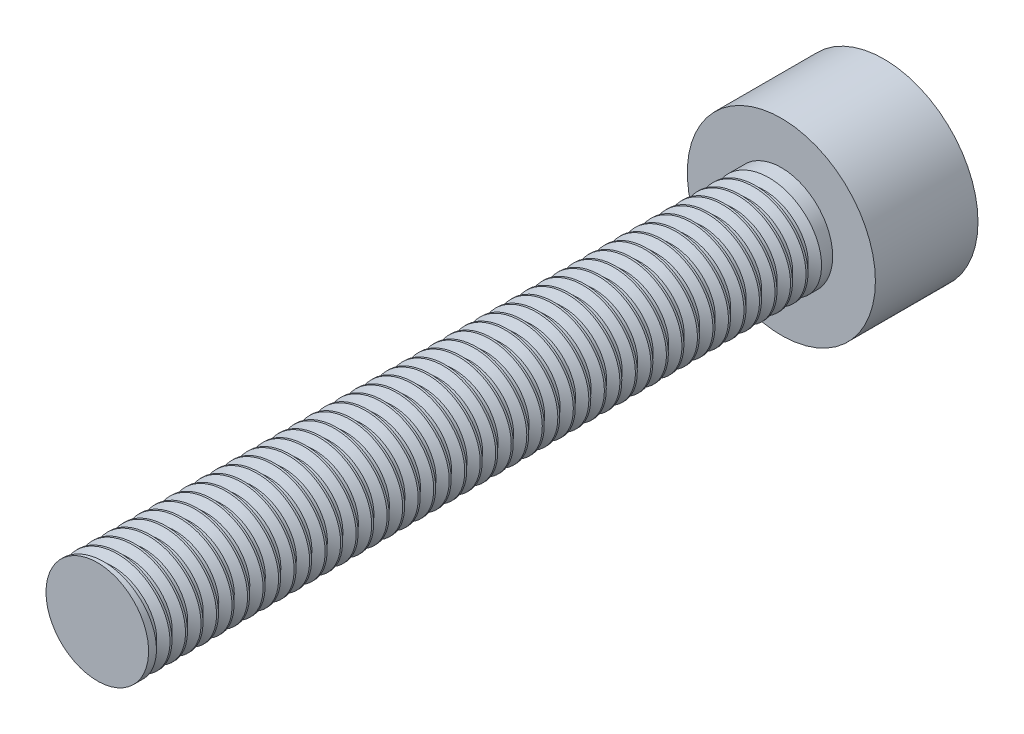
SolidWorks part; units mm, degrees
ref_plane "前视基准面" through (0, 0, 0) normal (0, 0, 1) x (1, 0, 0)
ref_plane "上视基准面" through (0, 0, 0) normal (0, 1, 0) x (1, 0, 0)
ref_plane "右视基准面" through (0, 0, 0) normal (1, 0, 0) x (0, 0, -1)
sketch "草图1" plane through (0, 0, 0) normal (0, 0, 1) x (1, 0, 0)
  circle A0 centre (0, 0) radius 2.75
  dimension "D1" = 5.5
extrude "凸台-拉伸1" add sketch "草图1" along normal blind 3
sketch "草图2" plane through (0, 0, 3) normal (0, 0, 1) x (1, 0, 0)
  circle A0 centre (0, 0) radius 1.5
  dimension "D1" = 3
extrude "凸台-拉伸2" add sketch "草图2" along normal blind 20
sketch "草图3" plane through (0, 0, 0) normal (0, 0, -1) x (-1, 0, 0)
  line L1 (1.1762, -1.2714) -> (1.6892, 0.3829)
  line L2 (1.6892, 0.3829) -> (0.513, 1.6543)
  line L3 (0.513, 1.6543) -> (-1.1762, 1.2714)
  line L4 (-1.1762, 1.2714) -> (-1.6892, -0.3829)
  line L5 (-1.6892, -0.3829) -> (-0.513, -1.6543)
  line L6 (-0.513, -1.6543) -> (1.1762, -1.2714)
  circle A0 centre (0, 0) radius 1.5 construction
  dimension "D1" = 3
extrude "切除-拉伸1" cut sketch "草图3" against normal blind 1.5
thread "螺纹线1" pitch 0.4536 start angle 0, offset 0, length 19.5, pitch 0.4536, diameter 3
ref_plane "基准面4" through (-1.5, 0, 23) normal (0, -1, 0) x (-1, 0, 0)
sketch "螺纹线轮廓1" plane through (-1.5, 0, 23) normal (0, -1, 0) x (-1, 0, 0)
  line L0 (0, 0) -> (0, 0.4536) construction
  line L11 (0, 0) -> (0, 0.3969)
  line L12 (0, 0.3969) -> (-0.2455, 0.2551)
  line L13 (-0.2455, 0.2551) -> (-0.2455, 0.1417)
  line L15 (-0.2455, 0.1417) -> (0, 0)
  line L17 (-0.2455, 0.1984) -> (0, 0.1984) construction
  point P2 (0, 0)
  dimension "Pitch" = 0.4536
  dimension "Profile_Angle" = 60
  dimension "Profile_Land" = 0.1134
  dimension "Profile_Height" = 0.2455
